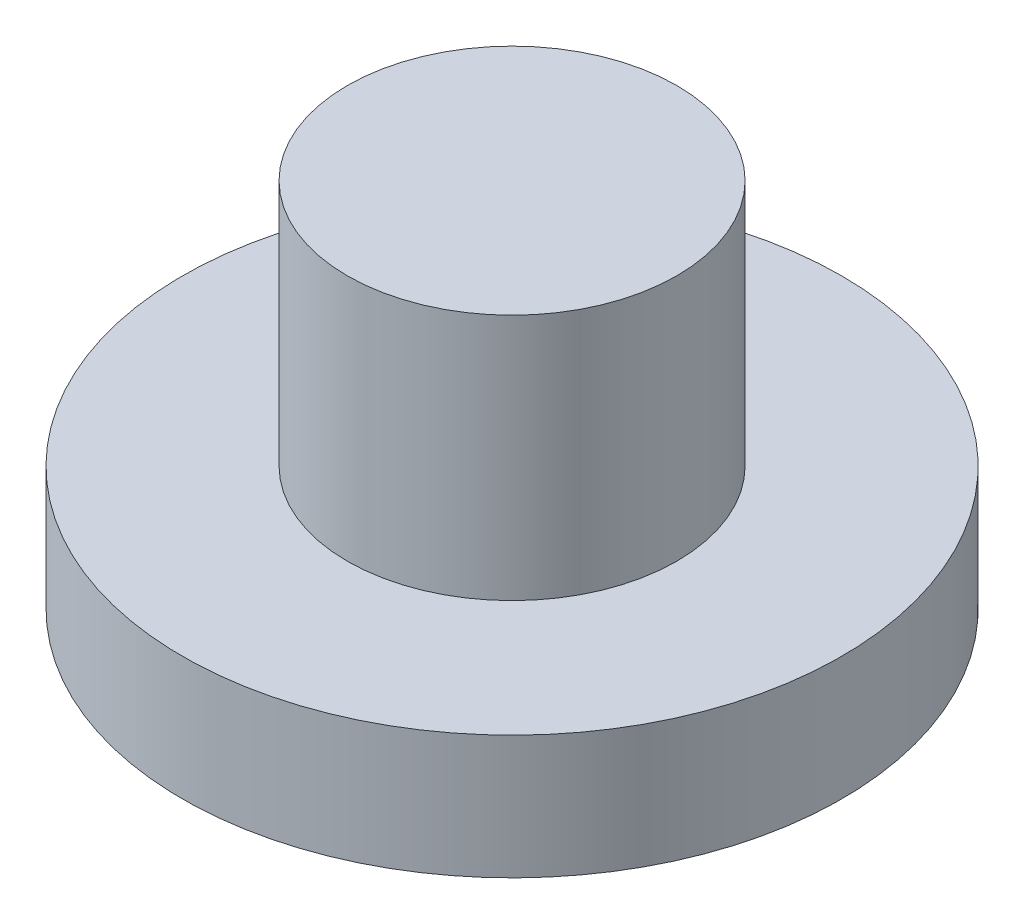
SolidWorks part; units mm, degrees
ref_plane "Front" through (0, 0, 0) normal (0, 0, 1) x (1, 0, 0)
ref_plane "Top" through (0, 0, 0) normal (0, 1, 0) x (1, 0, 0)
ref_plane "Right" through (0, 0, 0) normal (1, 0, 0) x (0, 0, -1)
sketch "Sketch1" plane through (0, 0, 0) normal (0, 0, 1) x (1, 0, 0)
  line L0 (0, 0) -> (0, 45) construction
  line L1 (0, 0) -> (-40, 0)
  line L2 (-40, 0) -> (-40, 15)
  line L3 (-40, 15) -> (-20, 15)
  line L4 (-20, 15) -> (-20, 45)
  line L5 (-20, 45) -> (0, 45)
  line L6 (0, 0) -> (0, 45)
  dimension "D1" = 40
  dimension "D2" = 80
  dimension "D3" = 15
  dimension "D4" = 45
revolve "Revolve1" add sketch "Sketch1" angle 360 about L0
